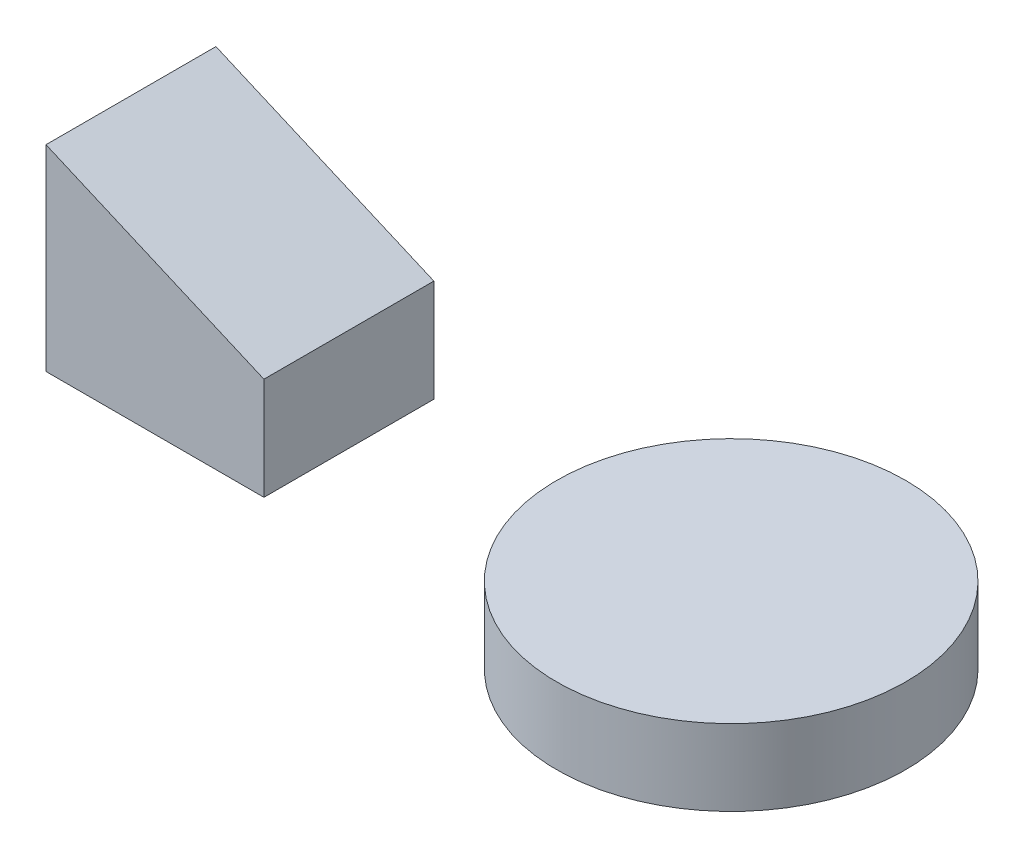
SolidWorks part; units mm, degrees
ref_plane "Front Plane" through (0, 0, 0) normal (0, 0, 1) x (1, 0, 0)
ref_plane "Top Plane" through (0, 0, 0) normal (0, 1, 0) x (1, 0, 0)
ref_plane "Right Plane" through (0, 0, 0) normal (1, 0, 0) x (0, 0, -1)
sketch "Sketch1" plane through (0, 0, 0) normal (0, 0, 1) x (1, 0, 0)
  line L1 (0, 0) -> (124.4322, 0)
  line L2 (0, 0) -> (0, 112.1679)
  line L3 (0, 112.1679) -> (124.4322, 58.428)
  line L4 (124.4322, 0) -> (124.4322, 58.428)
extrude "Extrude1" add sketch "Sketch1" along normal blind 97.028
sketch "Sketch2" plane through (0, 0, 0) normal (0, 1, 0) x (1, 0, 0)
  circle A0 centre (342.6991, -48.514) radius 99.6579
extrude "Extrude2" add sketch "Sketch2" along normal blind 43.434
